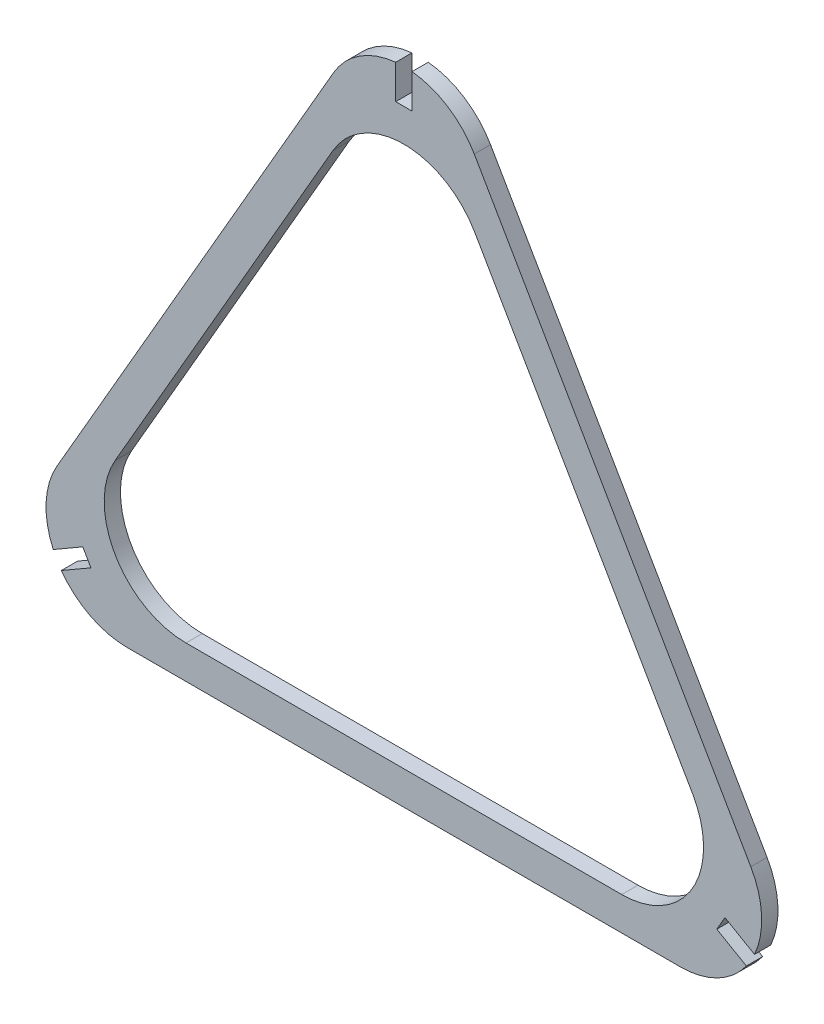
SolidWorks part; units mm, degrees
ref_plane "Спереди" through (0, 0, 0) normal (0, 0, 1) x (1, 0, 0)
ref_plane "Сверху" through (0, 0, 0) normal (0, 1, 0) x (1, 0, 0)
ref_plane "Справа" through (0, 0, 0) normal (1, 0, 0) x (0, 0, -1)
body saved out of another part "Заготовка-Деталь1-1"
